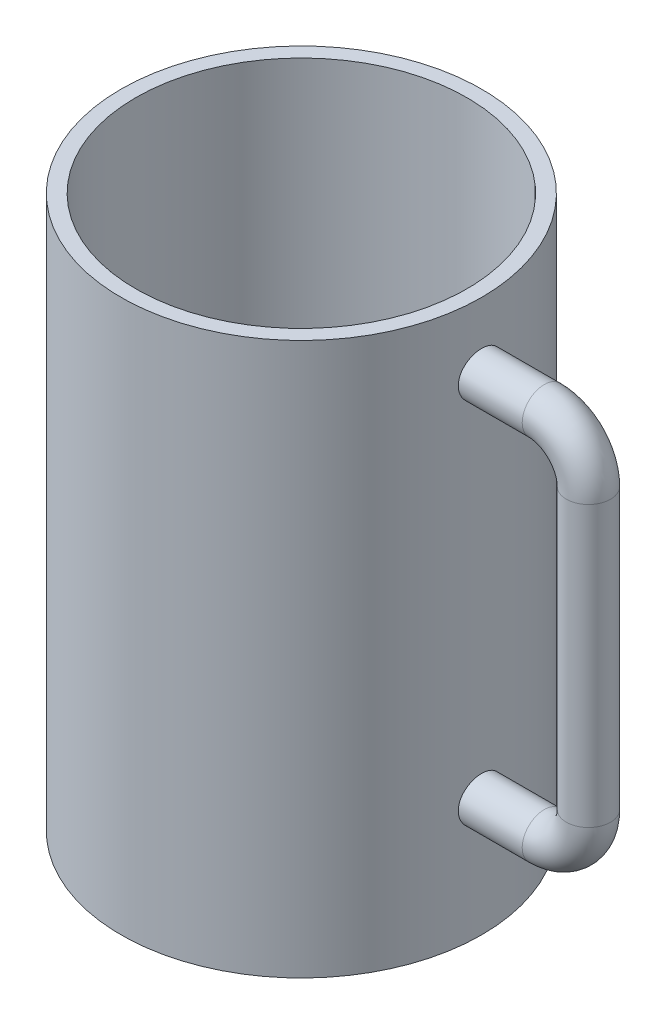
SolidWorks part; units mm, degrees
ref_plane "Front Plane" through (0, 0, 0) normal (0, 0, 1) x (1, 0, 0)
ref_plane "Top Plane" through (0, 0, 0) normal (0, 1, 0) x (1, 0, 0)
ref_plane "Right Plane" through (0, 0, 0) normal (1, 0, 0) x (0, 0, -1)
sketch "Sketch1" plane through (0, 0, 0) normal (0, 0, 1) x (1, 0, 0)
  line L0 (10, -12) -> (10, -20)
  line L1 (10, -20) -> (59, -20)
  line L2 (59, -20) -> (59, 130)
  line L3 (59, 130) -> (55, 130)
  line L4 (55, 130) -> (55, -12)
  line L5 (55, -12) -> (10, -12)
  dimension "D1" = 20
  dimension "D2" = 55
  dimension "D3" = 4
  dimension "D4" = 150
  dimension "D5" = 10
  dimension "D6" = 8
revolve "Revolve1" add sketch "Sketch1" angle 360 about L0
ref_plane "Plane1" through (56, 0, 0) normal (1, 0, 0) x (0, 0, -1)
sketch "Sketch2" plane through (56, 0, 0) normal (1, 0, 0) x (0, 0, -1)
  line L0 (0, 53.9) -> (0, -53.9) construction
  line L1 (45, 130) -> (-45, 130) construction
  circle A0 centre (0, 112) radius 6
  dimension "D1" = 12
  dimension "D2" = 18
sketch "Sketch3" plane through (0, 0, 0) normal (0, 0, 1) x (1, 0, 0)
  line L0 (56, 112) -> (76, 112)
  line L1 (56, -53.9) -> (56, 53.9) construction
  line L2 (56, 12) -> (76, 12)
  line L3 (88, 24) -> (88, 100)
  line L4 (55, 130) -> (-35, 130) construction
  line L5 (59, -20) -> (59, 130) construction
  arc A0 (76, 12) -> (88, 24) centre (76, 24) ccw
  arc A1 (88, 100) -> (76, 112) centre (76, 100) ccw
  dimension "D3" = 12
  dimension "D1" = 18
  dimension "D2" = 17
  dimension "D4" = 100
sweep "Sweep1" add profiles "Sketch2" path "Sketch3"
